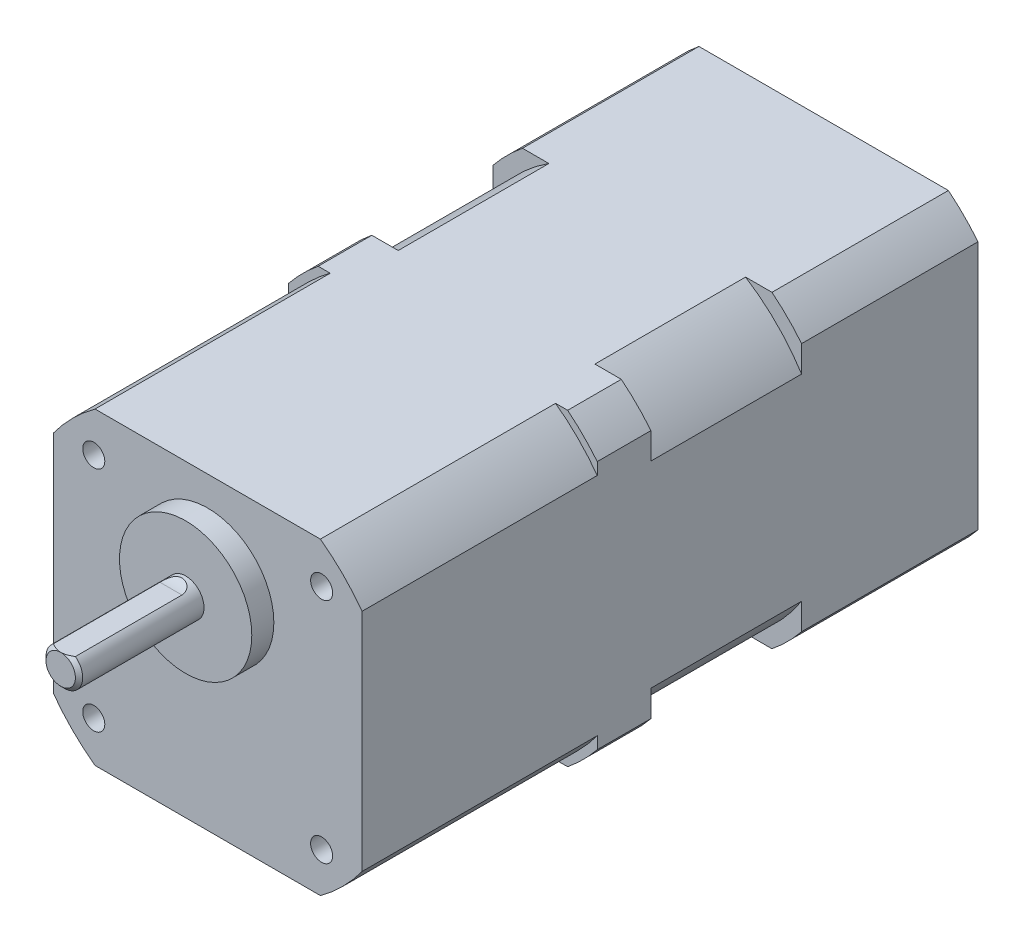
SolidWorks part; units mm, degrees
ref_plane "Front" through (0, 0, 0) normal (0, 0, 1) x (1, 0, 0)
ref_plane "Top" through (0, 0, 0) normal (0, 1, 0) x (1, 0, 0)
ref_plane "Right" through (0, 0, 0) normal (1, 0, 0) x (0, 0, -1)
sketch "Sketch1" plane through (0, 0, 0) normal (0, 0, 1) x (1, 0, 0)
  circle A0 centre (0, 0) radius 9
  dimension "D1" = 18
extrude "Extrude1" add sketch "Sketch1" along normal blind 3
sketch "Sketch2" plane through (0, 0, 3) normal (0, 0, 1) x (1, 0, 0)
  circle A0 centre (0, 0) radius 2.5
  dimension "D1" = 5
extrude "Extrude2" add sketch "Sketch2" along normal blind 17
sketch "Sketch3" plane through (0, 0, 0) normal (1, 0, 0) x (0, 0, -1)
  line L0 (-20, 0) -> (0, 0) construction
  line L1 (-20, 2.5) -> (-20, -2.5) construction
  line L2 (-20, 2) -> (-5, 2)
  line L3 (-3.5, 2.5) -> (-3.5, 0) construction
  line L4 (-3, 2.5) -> (-20, 2.5) construction
  line L5 (-20, 2) -> (-20, 7)
  line L6 (-20, 7) -> (-5, 7)
  line L7 (-3.5, 2.5) -> (-20, 2.5)
  circle A0 centre (-5, 4.5) radius 2.5
  dimension "D3" = 5
  dimension "D1" = 2
  dimension "D2" = 15
extrude "Extrude3" cut sketch "Sketch3" against normal mid plane 5 contours A0 L7 L5 L2 | L7 A0
chamfer "Chamfer1" distance 0.5 angle 45 1 edges at (0, -2.5, 20)
sketch "Sketch4" plane through (0, 0, 0) normal (0, 0, -1) x (-1, 0, 0)
  line L0 (0, 0) -> (0, -8) construction
  line L1 (-21, -29) -> (21, -29)
  line L2 (-21, -29) -> (-21, 13)
  line L3 (-21, 13) -> (21, 13)
  line L4 (21, -29) -> (21, 13)
  line L5 (-21, -29) -> (21, 13) construction
  line L6 (-21, 13) -> (21, -29) construction
  circle A0 centre (0, -8) radius 26
  point P0 (0, -8)
  dimension "D4" = 52
  dimension "D1" = 8
  dimension "D2" = 42
  dimension "D3" = 42
extrude "Extrude4" add sketch "Sketch4" along normal blind 32 contours L4 A0 L3 L2 L1 M4 | M4
sketch "Sketch5" plane through (0, 0, -32) normal (0, 0, -1) x (-1, 0, 0)
  line L1 (-21, -29) -> (21, -29)
  line L2 (-21, -29) -> (-21, 13)
  line L3 (-21, 13) -> (21, 13)
  line L4 (21, -23.3297) -> (21, 7.3297)
  line L5 (15.3297, 13) -> (-15.3297, 13)
  line L6 (-21, 7.3297) -> (-21, -23.3297)
  line L7 (-15.3297, -29) -> (15.3297, -29)
  line L8 (21, -23.3297) -> (21, 7.3297)
  line L9 (15.3297, 13) -> (-15.3297, 13)
  line L10 (-21, 7.3297) -> (-21, -23.3297)
  line L11 (-15.3297, -29) -> (15.3297, -29)
  line L12 (21, -29) -> (21, 13)
  line L13 (-21, -29) -> (21, 13) construction
  line L14 (-21, 13) -> (21, -29) construction
  circle A0 centre (0, -8) radius 27
  arc A4 (21, 7.3297) -> (15.3297, 13) centre (0, -8) ccw
  arc A5 (-15.3297, 13) -> (-21, 7.3297) centre (0, -8) ccw
  arc A6 (-21, -23.3297) -> (-15.3297, -29) centre (0, -8) ccw
  arc A7 (15.3297, -29) -> (21, -23.3297) centre (0, -8) ccw
  arc A8 (21, 7.3297) -> (15.3297, 13) centre (0, -8) ccw
  arc A9 (-15.3297, 13) -> (-21, 7.3297) centre (0, -8) ccw
  arc A10 (-21, -23.3297) -> (-15.3297, -29) centre (0, -8) ccw
  arc A11 (15.3297, -29) -> (21, -23.3297) centre (0, -8) ccw
  dimension "D2" = 54
  dimension "D3" = 42
  dimension "D1" = 0
extrude "Extrude5" add sketch "Sketch5" along normal blind 7.3 contours M16 M9 M10 M11 M12 M13 M14 M15 | L3 A0 L2 M12 | L12 A0 L3 M10 | L1 A0 L12 M16 | L2 A0 L1 M14 | A10 L11 A11 L8 A8 L9 A9 L10
sketch "Sketch6" plane through (0, 0, -39.3) normal (0, 0, -1) x (-1, 0, 0)
  line L4 (21, -24.9706) -> (21, 8.9706)
  line L5 (16.9706, 13) -> (-16.9706, 13)
  line L6 (-21, 8.9706) -> (-21, -24.9706)
  line L7 (-16.9706, -29) -> (16.9706, -29)
  line L8 (21, -24.9706) -> (21, 8.9706)
  line L9 (16.9706, 13) -> (-16.9706, 13)
  line L10 (-21, 8.9706) -> (-21, -24.9706)
  line L11 (-16.9706, -29) -> (16.9706, -29)
  circle A0 centre (0, -8) radius 24.9
  arc A4 (-21, -24.9706) -> (-16.9706, -29) centre (0, -8) ccw
  arc A5 (-21, -24.9706) -> (-16.9706, -29) centre (0, -8) ccw
  arc A6 (16.9706, -29) -> (21, -24.9706) centre (0, -8) ccw
  arc A7 (16.9706, -29) -> (21, -24.9706) centre (0, -8) ccw
  arc A13 (21, 8.9706) -> (16.9706, 13) centre (0, -8) ccw
  arc A14 (21, 8.9706) -> (16.9706, 13) centre (0, -8) ccw
  arc A15 (-16.9706, 13) -> (-21, 8.9706) centre (0, -8) ccw
  arc A16 (-16.9706, 13) -> (-21, 8.9706) centre (0, -8) ccw
  dimension "D2" = 49.8
  dimension "D1" = 0
extrude "Extrude6" add sketch "Sketch6" along normal blind 20.5 contours L8 A0 L9 L10 L11
sketch "Sketch7" plane through (0, 0, -59.8) normal (0, 0, -1) x (-1, 0, 0)
  line L0 (0, 0) -> (0, -8) construction
  line L1 (-21, -29) -> (21, -29)
  line L2 (-21, -29) -> (-21, 13)
  line L3 (-21, 13) -> (21, 13)
  line L4 (21, -29) -> (21, 13)
  line L5 (-21, -29) -> (21, 13) construction
  line L6 (-21, 13) -> (21, -29) construction
  circle A0 centre (0, -8) radius 27
  point P0 (0, -8)
  dimension "D4" = 54
  dimension "D1" = 8
  dimension "D2" = 42
  dimension "D3" = 42
extrude "Extrude7" add sketch "Sketch7" along normal blind 10.5
sketch "Sketch11" plane through (0, 0, -70.3) normal (0, 0, -1) x (-1, 0, 0)
  line L4 (-16.9706, -29) -> (16.9706, -29)
  line L5 (21, -24.9706) -> (21, 8.9706)
  line L6 (16.9706, 13) -> (-16.9706, 13)
  line L7 (-21, 8.9706) -> (-21, -24.9706)
  line L8 (-16.9706, -29) -> (16.9706, -29)
  line L9 (21, -24.9706) -> (21, 8.9706)
  line L10 (16.9706, 13) -> (-16.9706, 13)
  line L11 (-21, 8.9706) -> (-21, -24.9706)
  arc A4 (16.9706, -29) -> (21, -24.9706) centre (0, -8) ccw
  arc A5 (21, 8.9706) -> (16.9706, 13) centre (0, -8) ccw
  arc A6 (-16.9706, 13) -> (-21, 8.9706) centre (0, -8) ccw
  arc A7 (-21, -24.9706) -> (-16.9706, -29) centre (0, -8) ccw
  arc A8 (16.9706, -29) -> (21, -24.9706) centre (0, -8) ccw
  arc A9 (21, 8.9706) -> (16.9706, 13) centre (0, -8) ccw
  arc A10 (-16.9706, 13) -> (-21, 8.9706) centre (0, -8) ccw
  arc A11 (-21, -24.9706) -> (-16.9706, -29) centre (0, -8) ccw
  dimension "D1" = 0
extrude "Extrude10" add sketch "Sketch11" along normal blind 13.5
sketch "Sketch10" plane through (0, 0, 0) normal (0, 0, 1) x (1, 0, 0)
  line L0 (0, 0) -> (0, -18.8658) construction
  line L1 (-15.5, -23.5) -> (15.5, -23.5) construction
  line L2 (-15.5, -23.5) -> (-15.5, 7.5) construction
  line L3 (-15.5, 7.5) -> (15.5, 7.5) construction
  line L4 (15.5, -23.5) -> (15.5, 7.5) construction
  line L5 (-15.5, -23.5) -> (15.5, 7.5) construction
  line L6 (-15.5, 7.5) -> (15.5, -23.5) construction
  circle A0 centre (-15.5, 7.5) radius 1.5
  circle A1 centre (15.5, 7.5) radius 1.5
  circle A2 centre (-15.5, -23.5) radius 1.5
  circle A3 centre (15.5, -23.5) radius 1.5
  point P0 (0, -8)
  dimension "D4" = 3
  dimension "D1" = 31
  dimension "D2" = 31
  dimension "D3" = 8
extrude "Extrude9" cut sketch "Sketch10" against normal blind 7
